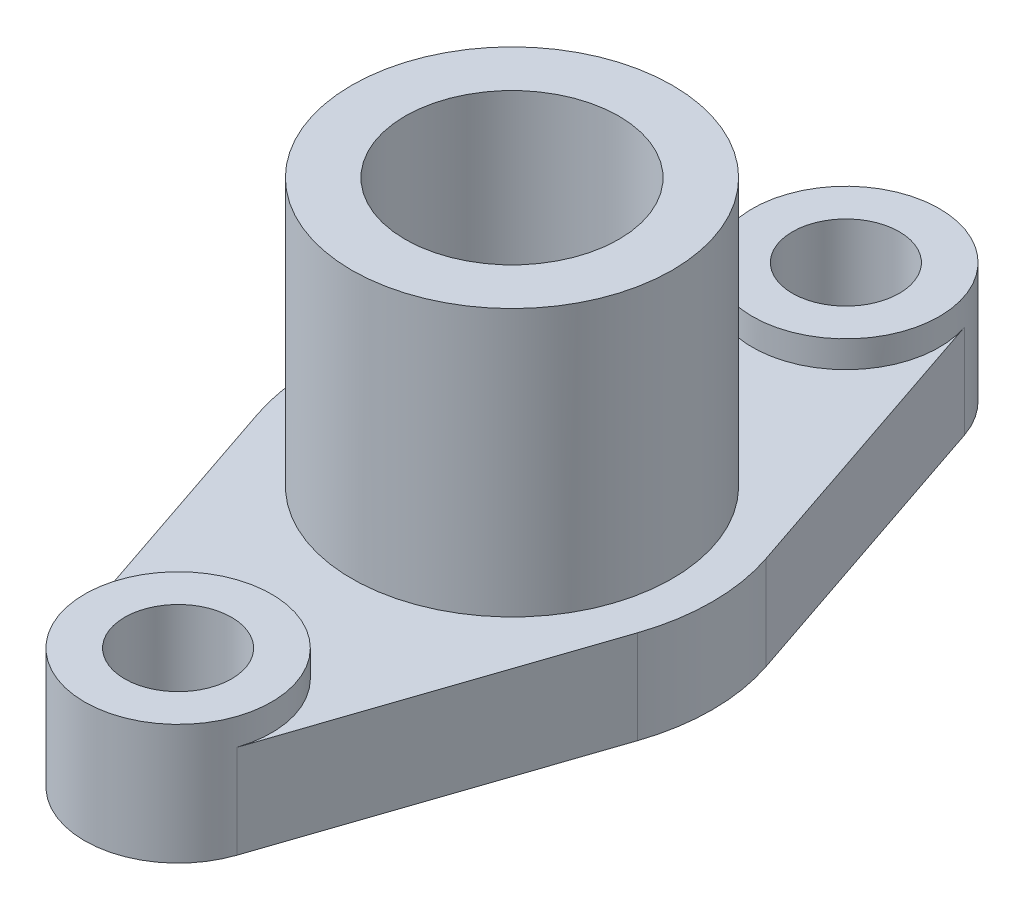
SolidWorks part; units mm, degrees
ref_plane "前视基准面" through (0, 0, 0) normal (0, 0, 1) x (1, 0, 0)
ref_plane "上视基准面" through (0, 0, 0) normal (0, 1, 0) x (1, 0, 0)
ref_plane "右视基准面" through (0, 0, 0) normal (1, 0, 0) x (0, 0, -1)
sketch "草图1" plane through (0, 0, 0) normal (0, 1, 0) x (1, 0, 0)
  circle A0 centre (0, 0) radius 12
  circle A1 centre (0, 0) radius 8
extrude "拉伸1" add sketch "草图1" along normal blind 27
sketch "草图2" plane through (0, 0, 0) normal (0, -1, 0) x (1, 0, 0)
  line L0 (0, 0) -> (0, -40.2281) construction
  line L1 (14.2113, -4.8) -> (6.6319, -27.24)
  line L2 (-14.2113, -4.8) -> (-6.6319, -27.24)
  line L3 (14.2113, 4.8) -> (6.6319, 27.24)
  line L4 (-6.6319, 27.24) -> (-14.2113, 4.8)
  arc A0 (14.2113, -4.8) -> (14.2113, 4.8) centre (0, 0) ccw
  arc A1 (-6.6319, -27.24) -> (6.6319, -27.24) centre (0, -25) ccw
  arc A2 (6.6319, 27.24) -> (-6.6319, 27.24) centre (0, 25) ccw
  arc A3 (-14.2113, 4.8) -> (-14.2113, -4.8) centre (0, 0) ccw
  circle A4 centre (0, -25) radius 4
  circle A5 centre (0, 25) radius 4
  circle A6 centre (0, 0) radius 8
  dimension "D1" = 14
  dimension "D2" = 14
extrude "拉伸2" add sketch "草图2" against normal blind 7
sketch "草图3" plane through (0, 7, 0) normal (0, 1, 0) x (-1, 0, 0)
  line L8 (0, 0) -> (24.3231, 0) construction
  circle A1 centre (0, 25) radius 7
  circle A2 centre (0, 25) radius 4
  circle A3 centre (0, -25) radius 4
  circle A4 centre (0, -25) radius 7
extrude "拉伸3" add sketch "草图3" along normal blind 2
